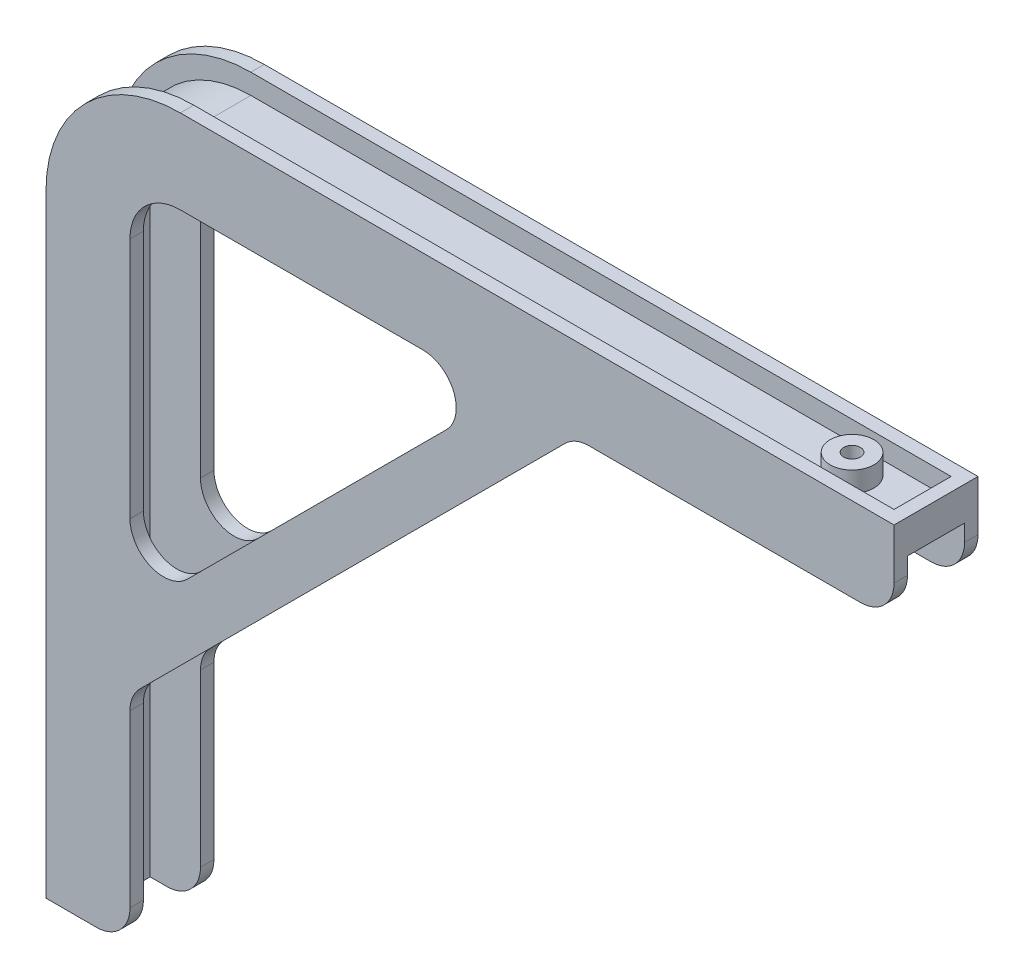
SolidWorks part; units mm, degrees
ref_plane "Plan de face" through (0, 0, 0) normal (0, 0, 1) x (1, 0, 0)
ref_plane "Plan de dessus" through (0, 0, 0) normal (0, 1, 0) x (1, 0, 0)
ref_plane "Plan de droite" through (0, 0, 0) normal (1, 0, 0) x (0, 0, -1)
sketch "Esquisse1" plane through (0, 0, 0) normal (0, 0, 1) x (1, 0, 0)
  line L0 (0, 0) -> (-212.5, 0)
  line L1 (-242.5, -30) -> (-242.5, -212.5)
  line L2 (-242.5, -212.5) -> (-252.5, -212.5)
  line L3 (-252.5, -212.5) -> (-252.5, -30)
  line L4 (-212.5, 10) -> (0, 10)
  line L5 (0, 10) -> (0, 0)
  arc A0 (-242.5, -30) -> (-212.5, 0) centre (-212.5, -30) cw
  arc A1 (-252.5, -30) -> (-212.5, 10) centre (-212.5, -30) cw
  point P11 (-252.5, 10)
  dimension "D4" = 30
  dimension "D5" = 40
  dimension "D1" = 10
  dimension "D2" = 252.5
  dimension "D3" = 222.5
extrude "Extrusion1" add sketch "Esquisse1" along normal mid plane 25
sketch "Esquisse2" plane through (-242.5, 0, 0) normal (1, 0, 0) x (0, 0, -1)
  line L0 (-12.5, 10) -> (12.5, 10) construction
  circle A0 centre (0, -50) radius 3
  circle A1 centre (0, -175) radius 3
  dimension "D1" = 6
  dimension "D2" = 60
  dimension "D3" = 125
extrude "Enlèv. mat.-Extru.1" cut sketch "Esquisse2" against normal through all
sketch "Esquisse3" plane through (0, 0, 0) normal (0, -1, 0) x (1, 0, 0)
  line L0 (0, 12.5) -> (0, -12.5) construction
  circle A0 centre (-25, 0) radius 2.5
  dimension "D1" = 5
  dimension "D2" = 25
extrude "Enlèv. mat.-Extru.2" cut sketch "Esquisse3" against normal through all
shell "Coque1" thickness 4
sketch "Esquisse4" plane through (0, 0, 12.5) normal (0, 0, 1) x (1, 0, 0)
  line L0 (-212.5, 0) -> (0, 0) construction
  line L1 (-242.5, -212.5) -> (-242.5, -30) construction
  line L2 (-212.5, 0) -> (0, 0)
  line L3 (-242.5, -212.5) -> (-242.5, -30)
  line L4 (-227.5, -202.5) -> (-227.5, -151.6421)
  line L5 (-212.5, -15) -> (-140.3553, -15)
  line L6 (-242.5, -212.5) -> (-237.5, -212.5)
  line L7 (0, 0) -> (0, -5)
  line L8 (-210.4289, -109.2157) -> (-133.2843, -32.0711)
  line L9 (-224.5711, -144.5711) -> (-97.9289, -17.9289)
  line L10 (-90.8579, -15) -> (-10, -15)
  line L11 (-212.5, -15) -> (0, -15) construction
  line L12 (-227.5, -102.1447) -> (-227.5, -30)
  line L13 (-227.5, -212.5) -> (-227.5, -30) construction
  arc A0 (-212.5, 0) -> (-242.5, -30) centre (-212.5, -30) ccw construction
  arc A1 (-212.5, 0) -> (-242.5, -30) centre (-212.5, -30) ccw
  arc A2 (-212.5, -15) -> (-227.5, -30) centre (-212.5, -30) ccw
  arc A3 (-10, -15) -> (0, -5) centre (-10, -5) ccw
  arc A4 (-237.5, -212.5) -> (-227.5, -202.5) centre (-237.5, -202.5) ccw
  arc A5 (-227.5, -102.1447) -> (-210.4289, -109.2157) centre (-217.5, -102.1447) ccw
  arc A6 (-133.2843, -32.0711) -> (-140.3553, -15) centre (-140.3553, -25) ccw
  arc A7 (-97.9289, -17.9289) -> (-90.8579, -15) centre (-90.8579, -25) cw
  arc A8 (-227.5, -151.6421) -> (-224.5711, -144.5711) centre (-217.5, -151.6421) cw
  point P22 (-227.5, -126.2868)
  point P27 (-95, -15)
  point P30 (-227.5, -147.5)
  dimension "D5" = 10
  dimension "D2" = 15
  dimension "D3" = 45
  dimension "D4" = 65
  dimension "D1" = 15
extrude "Extrusion2" add sketch "Esquisse4" against normal blind 4
mirror "Symétrie1" about plane through (0, 0, 0) normal (0, 0, 1) of "Extrusion2"
